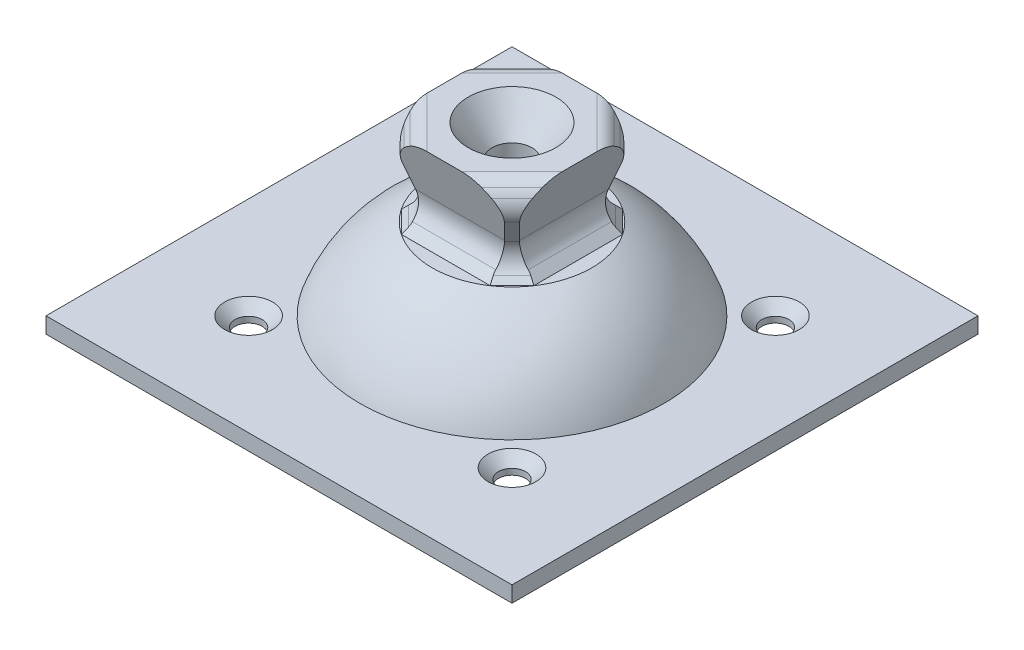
SolidWorks part; units mm, degrees
ref_plane "Front Plane" through (0, 0, 0) normal (0, 0, 1) x (1, 0, 0)
ref_plane "Top Plane" through (0, 0, 0) normal (0, 1, 0) x (1, 0, 0)
ref_plane "Right Plane" through (0, 0, 0) normal (1, 0, 0) x (0, 0, -1)
sketch "Sketch4" plane through (0, 0, 0) normal (0, 0, 1) x (1, 0, 0)
  line L1 (-8.5, -5.5) -> (8.5, -5.5)
  line L2 (-8.5, -5.5) -> (-8.5, 5.5)
  line L3 (-8.5, 5.5) -> (8.5, 5.5)
  line L4 (8.5, -5.5) -> (8.5, 5.5)
  line L5 (-8.5, -5.5) -> (8.5, 5.5) construction
  line L6 (-8.5, 5.5) -> (8.5, -5.5) construction
  point P0 (0, 0)
  dimension "D1" = 11
  dimension "D2" = 17
extrude "Boss-Extrude2" add sketch "Sketch4" along normal mid plane 17
sketch "Sketch5" plane through (0, 0, 0) normal (1, 0, 0) x (0, 0, -1)
  line L0 (0, -10) -> (0, 10) construction
  line L1 (8.5, 5.5) -> (6.5025, -1.2915)
  line L2 (8.5, -5.5) -> (7.2593, -4.2593)
  line L3 (-8.5, -5.5) -> (-7.2593, -4.2593)
  line L4 (-8.5, 5.5) -> (-6.5025, -1.2915)
  line L5 (-8.5, 5.5) -> (-8.5, -5.5)
  line L6 (8.5, -5.5) -> (8.5, 5.5)
  arc A0 (7.2593, -4.2593) -> (6.5025, -1.2915) centre (9.3806, -2.138) cw
  arc A1 (-7.2593, -4.2593) -> (-6.5025, -1.2915) centre (-9.3806, -2.138) ccw
  point P12 (6, -3)
  point P16 (-6, -3)
  dimension "D5" = 3
  dimension "D1" = 10
  dimension "D2" = 20
  dimension "D3" = 6
  dimension "D4" = 45
extrude "Cut-Extrude1" cut sketch "Sketch5" against normal mid plane 27
sketch "Sketch7" plane through (0, 0, 0) normal (0, 0, 1) x (1, 0, 0)
  line L0 (0, -10) -> (0, 10) construction
  line L1 (8.5, 5.5) -> (6.5025, -1.2915)
  line L2 (8.5, -5.5) -> (7.2593, -4.2593)
  line L3 (-8.5, -5.5) -> (-7.2593, -4.2593)
  line L4 (-8.5, 5.5) -> (-6.5025, -1.2915)
  line L5 (-8.5, 5.5) -> (-8.5, -5.5)
  line L6 (8.5, -5.5) -> (8.5, 5.5)
  line L7 (8.5, -4.2593) -> (8.5, -5.5) construction
  arc A0 (7.2593, -4.2593) -> (6.5025, -1.2915) centre (9.3806, -2.138) cw
  arc A1 (-7.2593, -4.2593) -> (-6.5025, -1.2915) centre (-9.3806, -2.138) ccw
  point P12 (-6, -3)
  dimension "D3" = 3
  dimension "D1" = 20
  dimension "D2" = 45
  dimension "D4" = 16.389
extrude "Cut-Extrude2" cut sketch "Sketch7" against normal mid plane 27
sketch "Sketch8" plane through (0, 5.5, 0) normal (0, 1, 0) x (1, 0, 0)
  line L0 (3.5355, 3.5355) -> (-3.5355, -3.5355) construction
  line L1 (-5, 0) -> (5, 0) construction
  line L2 (-3.5355, 3.5355) -> (3.5355, -3.5355) construction
  line L3 (0, 5) -> (0, -5) construction
  dimension "D1" = 10
  dimension "D2" = 10
  dimension "D3" = 10
  dimension "D4" = 45
  dimension "D5" = 45
  dimension "D6" = 10
sketch "Sketch9" plane through (0, 0, 0) normal (0, 1, 0) x (1, 0, 0)
  line L0 (3.5355, 3.5355) -> (-3.5355, -3.5355) construction
  line L1 (-5, 0) -> (5, 0) construction
  line L2 (-3.5355, 3.5355) -> (3.5355, -3.5355) construction
  line L3 (0, 5) -> (0, -5) construction
  point P8 (0, 0)
  point P10 (0, 0)
  point P11 (0, 0)
  dimension "D1" = 10
  dimension "D2" = 10
  dimension "D3" = 10
  dimension "D4" = 45
  dimension "D5" = 45
  dimension "D6" = 10
ref_plane "Plane1" through (0, 0, 0) normal (0.7071, 0, 0.7071) x (0.7071, 0, -0.7071)
ref_plane "Plane2" through (0, 0, 0) normal (0.7071, 0, -0.7071) x (-0.7071, 0, -0.7071)
sketch "Sketch11" plane through (0, 0, 0) normal (0.7071, 0, 0.7071) x (0.7071, 0, -0.7071)
  line L0 (-10, 5.5) -> (10, 5.5) construction
  line L1 (0, -5.5) -> (0, 5.5) construction
  line L2 (10, 5.5) -> (10, -5.5) construction
  line L3 (0, -5.5) -> (12.0208, -5.5) construction
  line L4 (10, -5.5) -> (0, -5.5) construction
  line L5 (10, -5.5) -> (9.1595, -4.6595)
  line L6 (10, 5.5) -> (10, 2.3) construction
  line L7 (0, 5.5) -> (8.25, 5.5) construction
  line L8 (9.6935, 1.5413) -> (8.4993, -1.4144)
  line L10 (10, -5.5) -> (14, -5.5)
  line L11 (14, -5.5) -> (14, 5.5)
  line L12 (14, 5.5) -> (8.25, 5.5)
  line L13 (-14, 5.5) -> (-8.25, 5.5)
  line L14 (-9.6935, 1.5413) -> (-8.4993, -1.4144)
  line L15 (-10, -5.5) -> (-9.1595, -4.6595)
  line L16 (-10, -5.5) -> (-14, -5.5)
  line L17 (-14, -5.5) -> (-14, 5.5)
  arc A0 (9.5819, 4.0331) -> (8.25, 5.5) centre (6.1993, 2.3) ccw
  arc A1 (9.5819, 4.0331) -> (9.6935, 1.5413) centre (6.9119, 2.6651) cw
  arc A2 (9.1595, -4.6595) -> (8.4993, -1.4144) centre (11.2808, -2.5382) cw
  arc A3 (-9.5819, 4.0331) -> (-9.6935, 1.5413) centre (-6.9119, 2.6651) ccw
  arc A4 (-9.5819, 4.0331) -> (-8.25, 5.5) centre (-6.1993, 2.3) cw
  arc A5 (-9.1595, -4.6595) -> (-8.4993, -1.4144) centre (-11.2808, -2.5382) ccw
  dimension "D7" = 3
  dimension "D8" = 3
  dimension "D1" = 20
  dimension "D2" = 11
  dimension "D3" = 45
  dimension "D4" = 8.25
  dimension "D5" = 3.2
  dimension "D6" = 22
  dimension "D9" = 4
extrude "Cut-Extrude3" cut sketch "Sketch11" against normal mid plane 27
sketch "Sketch12" plane through (0, 0, 0) normal (0.7071, 0, -0.7071) x (-0.7071, 0, -0.7071)
  line L0 (-10, 5.5) -> (10, 5.5) construction
  line L1 (0, -5.5) -> (0, 5.5) construction
  line L2 (10, 5.5) -> (10, -5.5) construction
  line L3 (10, -5.5) -> (0, -5.5) construction
  line L4 (10, -5.5) -> (9.1595, -4.6595)
  line L5 (10, 5.5) -> (10, 2.3) construction
  line L6 (0, 5.5) -> (8.25, 5.5) construction
  line L7 (9.6935, 1.5413) -> (8.4993, -1.4144)
  line L8 (10, -5.5) -> (14, -5.5)
  line L9 (14, -5.5) -> (14, 5.5)
  line L10 (14, 5.5) -> (8.25, 5.5)
  line L11 (-14, 5.5) -> (-8.25, 5.5)
  line L12 (-9.6935, 1.5413) -> (-8.4993, -1.4144)
  line L13 (-10, -5.5) -> (-9.1595, -4.6595)
  line L14 (-10, -5.5) -> (-14, -5.5)
  line L15 (-14, -5.5) -> (-14, 5.5)
  arc A0 (9.5819, 4.0331) -> (8.25, 5.5) centre (6.1993, 2.3) ccw
  arc A1 (9.5819, 4.0331) -> (9.6935, 1.5413) centre (6.9119, 2.6651) cw
  arc A2 (9.1595, -4.6595) -> (8.4993, -1.4144) centre (11.2808, -2.5382) cw
  arc A3 (-9.5819, 4.0331) -> (-9.6935, 1.5413) centre (-6.9119, 2.6651) ccw
  arc A4 (-9.5819, 4.0331) -> (-8.25, 5.5) centre (-6.1993, 2.3) cw
  arc A5 (-9.1595, -4.6595) -> (-8.4993, -1.4144) centre (-11.2808, -2.5382) ccw
  dimension "D7" = 3
  dimension "D8" = 3
  dimension "D1" = 20
  dimension "D2" = 11
  dimension "D3" = 45
  dimension "D4" = 8.25
  dimension "D5" = 3.2
  dimension "D6" = 22
  dimension "D9" = 4
extrude "Cut-Extrude4" cut sketch "Sketch12" against normal mid plane 27
sketch "Sketch14" plane through (0, 0, 0) normal (0, 0, 1) x (1, 0, 0)
  line L0 (0, 5.5) -> (0, -5.5) construction
  line L1 (0, 5.5) -> (5.5, 5.5)
  line L2 (3.1673, 5.5) -> (8.5, 5.5) construction
  line L3 (5.5, 5.5) -> (5.5, 1.5) construction
  line L4 (0, 1.5) -> (2.5, 1.5) construction
  line L5 (2.5, 1.5) -> (5.5, 5.5)
  line L6 (2.5, 1.5) -> (2.5, -5.5)
  line L7 (-5.6421, -5.5) -> (5.6421, -5.5) construction
  line L8 (0, -5.5) -> (0, 5.5)
  line L9 (2.5, -5.5) -> (0, -5.5)
  dimension "D1" = 11
  dimension "D2" = 5.5
  dimension "D3" = 4
  dimension "D4" = 2.5
revolve "Cut-Revolve1" cut sketch "Sketch14" angle 360 about L8
fillet "Fillet1" radius 2 4 edges at (5.8336, 5.5, -5.8336) (-5.8336, 5.5, -5.8336) (-5.8336, 5.5, 5.8336) (5.8336, 5.5, 5.8336)
sketch "Sketch15" plane through (0, 0, 0) normal (1, 0, 0) x (0, 0, -1)
  line L0 (0, -5.5) -> (0, -15.5) construction
  line L1 (-5.6421, -5.5) -> (5.6421, -5.5) construction
  line L3 (0, -15.5) -> (19.05, -15.5)
  line L4 (0, -15.5) -> (0, -5.5)
  line L5 (0, -5.5) -> (0, -5.3)
  line L6 (0, -5.3) -> (9.998, -5.3)
  arc A0 (9.998, -5.3) -> (19.05, -15.5) centre (2.0644, -21.4573) cw
  dimension "D4" = 18
  dimension "D1" = 10
  dimension "D2" = 10
  dimension "D3" = 19.05
  dimension "D5" = 0.2
revolve "Revolve1" add sketch "Sketch15" angle 360 about L0
sketch "Sketch16" plane through (0, -15.5, 0) normal (0, -1, 0) x (1, 0, 0)
  line L0 (-8, 0) -> (8, 0)
  circle A0 centre (8, 0) radius 3
  circle A1 centre (-8, 0) radius 3
  point P5 (0, 0)
  dimension "D1" = 6
  dimension "D2" = 16
ref_plane "Plane3" through (0, -15.5, 0) normal (0, -1, 0) x (-1, 0, 0)
sketch "Sketch17" plane through (0, -15.5, 0) normal (0, -1, 0) x (-1, 0, 0)
  line L9 (-29.21, -29.21) -> (29.21, -29.21)
  line L10 (-29.21, -29.21) -> (-29.21, 29.21)
  line L11 (-29.21, 29.21) -> (29.21, 29.21)
  line L12 (29.21, -29.21) -> (29.21, 29.21)
  line L13 (-29.21, -29.21) -> (29.21, 29.21) construction
  line L14 (-29.21, 29.21) -> (29.21, -29.21) construction
  point P0 (0, 0)
  dimension "D1" = 58.42
extrude "Boss-Extrude3" add sketch "Sketch17" along normal blind 2 contours L9 L12 L11 L10
sketch "Sketch21" plane through (0, -15.5, 0) normal (0, 1, 0) x (1, 0, 0)
  line L0 (-29.21, -29.21) -> (-29.21, 29.21) construction
  line L1 (29.21, -29.21) -> (29.21, 29.21) construction
  line L2 (29.21, 29.21) -> (-29.21, 29.21) construction
  line L3 (29.21, -29.21) -> (-29.21, -29.21) construction
  circle A0 centre (16.51, -16.51) radius 3.175
  circle A1 centre (16.51, 16.51) radius 3.175
  circle A2 centre (-16.51, 16.51) radius 3.175
  circle A3 centre (-16.51, -16.51) radius 3.175
  point P0 (16.51, -16.51)
  point P12 (16.51, 16.51)
  point P14 (-16.51, 16.51)
  point P16 (-16.51, -16.51)
  point P22 (0, 0)
  point P23 (0, 0)
  point P24 (0, 0)
  point P25 (0, 0)
  dimension "D1" = 6.35
  dimension "D2" = 12.7
  dimension "D3" = 12.7
  dimension "D4" = 12.7
  dimension "D5" = 12.7
hole_wizard "CSK for M3 Cross Countersunk Head Screw1" positions "Sketch21" profile "Sketch22" countersink size "M3" standard "AS"
sketch "Sketch22" plane through (16.51, -15.5, 16.51) normal (1, 0, 0) x (0, 0, 1)
  line L0 (0, 0) -> (0, 2)
  line L1 (0, 2) -> (1.7, 2)
  line L2 (1.7, 2) -> (1.7, 1.2554)
  line L3 (1.7, 1.2554) -> (3, 0)
  line L5 (3, 0) -> (0, 0)
  line L6 (-1.7, 1.2554) -> (-3, 0) construction
  line L11 (0, -6.35) -> (0, 107.95) construction
  dimension "Thru Hole Dia." = 3.4
  dimension "Thru Hole Depth" = 2
  dimension "Near C'Sink Dia." = 6
  dimension "Near C'Sink Angle" = 92
